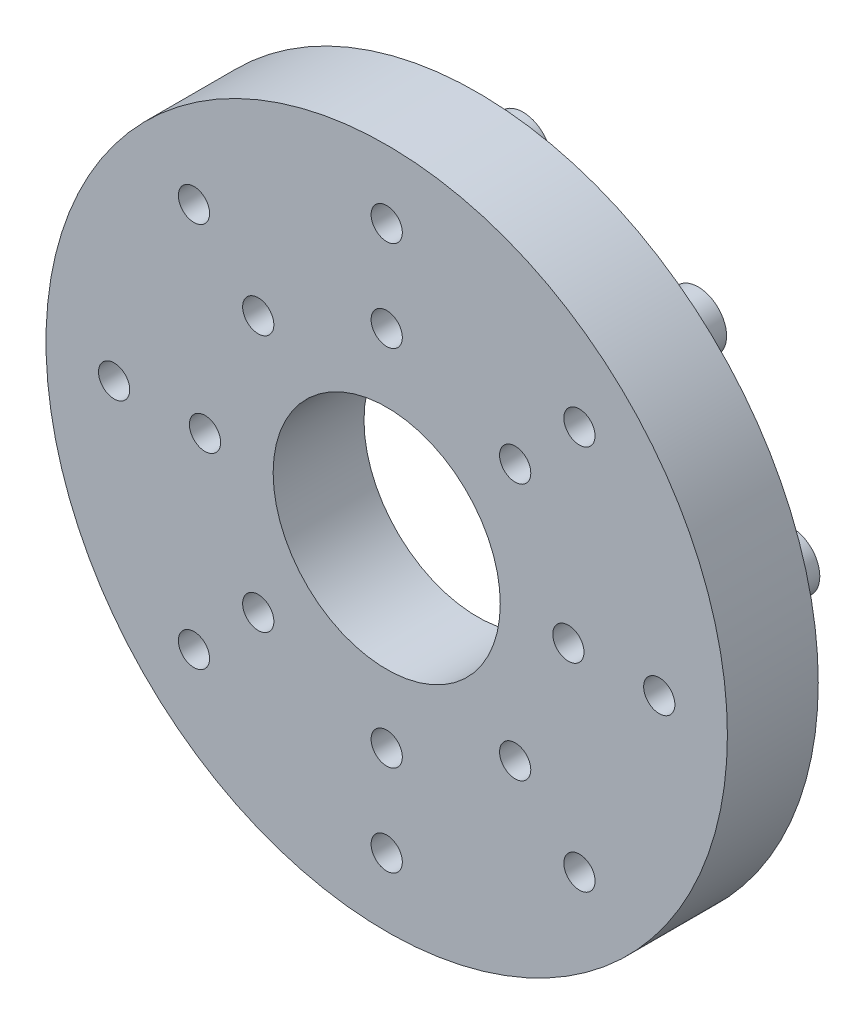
SolidWorks part; units mm, degrees
ref_plane "Front Plane" through (0, 0, 0) normal (0, 0, 1) x (1, 0, 0)
ref_plane "Top Plane" through (0, 0, 0) normal (0, 1, 0) x (1, 0, 0)
ref_plane "Right Plane" through (0, 0, 0) normal (1, 0, 0) x (0, 0, -1)
sketch "Sketch2" plane through (0, 0, 0) normal (0, 0, 1) x (1, 0, 0)
  circle A0 centre (0, 0) radius 190.5
  circle A1 centre (0, 0) radius 63.5
  dimension "D1" = 381
  dimension "D2" = 127
extrude "Boss-Extrude1" add sketch "Sketch2" along normal mid plane 50.8
sketch "Sketch3" plane through (0, 0, -25.4) normal (0, 0, -1) x (-1, 0, 0)
  circle A0 centre (0, 0) radius 152.4 construction
  circle A1 centre (0, 152.4) radius 15.875
  circle A2 centre (97.9608, 116.7452) radius 15.875
  circle A3 centre (150.0847, 26.464) radius 15.875
  circle A4 centre (131.9823, -76.2) radius 15.875
  circle A5 centre (52.1239, -143.2092) radius 15.875
  circle A6 centre (-52.1239, -143.2092) radius 15.875
  circle A7 centre (-131.9823, -76.2) radius 15.875
  circle A8 centre (-150.0847, 26.464) radius 15.875
  circle A9 centre (-97.9608, 116.7452) radius 15.875
  point P23 (0, 0)
  dimension "D1" = 304.8
  dimension "D2" = 31.75
  dimension "D3" = 9
extrude "Boss-Extrude2" add sketch "Sketch3" along normal blind 25.4
sketch "Sketch5" plane through (0, 0, 25.4) normal (0, 0, 1) x (1, 0, 0)
  line L0 (0, 152.4) -> (0, -152.4) construction
  line L1 (152.4, 0) -> (-152.4, 0) construction
  line L2 (0, 0) -> (-107.7631, 107.7631) construction
  line L3 (0, 0) -> (107.7631, -107.7631) construction
  line L4 (0, 0) -> (-107.7631, -107.7631) construction
  line L5 (0, 0) -> (107.7631, 107.7631) construction
  circle A0 centre (0, 0) radius 101.5873 construction
  circle A1 centre (0, 0) radius 152.4 construction
  point P4 (0, 101.5873)
  point P5 (101.5873, 0)
  point P6 (0, -101.5873)
  point P7 (-101.5873, 0)
  point P12 (71.8331, 71.8331)
  point P17 (71.8331, -71.8331)
  point P18 (-71.8331, -71.8331)
  point P19 (-71.8331, 71.8331)
  dimension "D1" = 203.1746
  dimension "D2" = 304.8
  dimension "D3" = 45
hole_wizard "3/4-16 Tapped Hole1" positions "Sketch7" profile "Sketch6" tap size "3/4-16" standard "ANSI Inch"
sketch "Sketch7" plane through (0, 0, 25.4) normal (0, 0, 1) x (1, 0, 0)
  point P0 (0, 101.5873)
  point P3 (0, 152.4)
  point P6 (107.7631, 107.7631)
  point P9 (71.8331, 71.8331)
  point P12 (101.5873, 0)
  point P15 (152.4, 0)
  point P18 (71.8331, -71.8331)
  point P21 (107.7631, -107.7631)
  point P24 (0, -101.5873)
  point P27 (0, -152.4)
  point P30 (-107.7631, -107.7631)
  point P33 (-71.8331, -71.8331)
  point P36 (-152.4, 0)
  point P39 (-101.5873, 0)
  point P42 (-71.8331, 71.8331)
  point P45 (-107.7631, 107.7631)
sketch "Sketch6" plane through (0, 101.5873, 25.4) normal (1, 0, 0) x (0, -1, 0)
  line L0 (0, 0) -> (0, 48.1723)
  line L1 (0, 48.1723) -> (8.7312, 42.926)
  line L2 (8.7312, 42.926) -> (8.7312, 0)
  line L5 (8.7312, 0) -> (0, 0)
  line L10 (0, 48.1723) -> (-8.7313, 42.926) construction
  line L11 (0, -6.35) -> (0, 107.95) construction
  dimension "Tap Drill Dia." = 17.4625
  dimension "Tap Drill Depth" = 42.926
  dimension "Drill Angle" = 118
